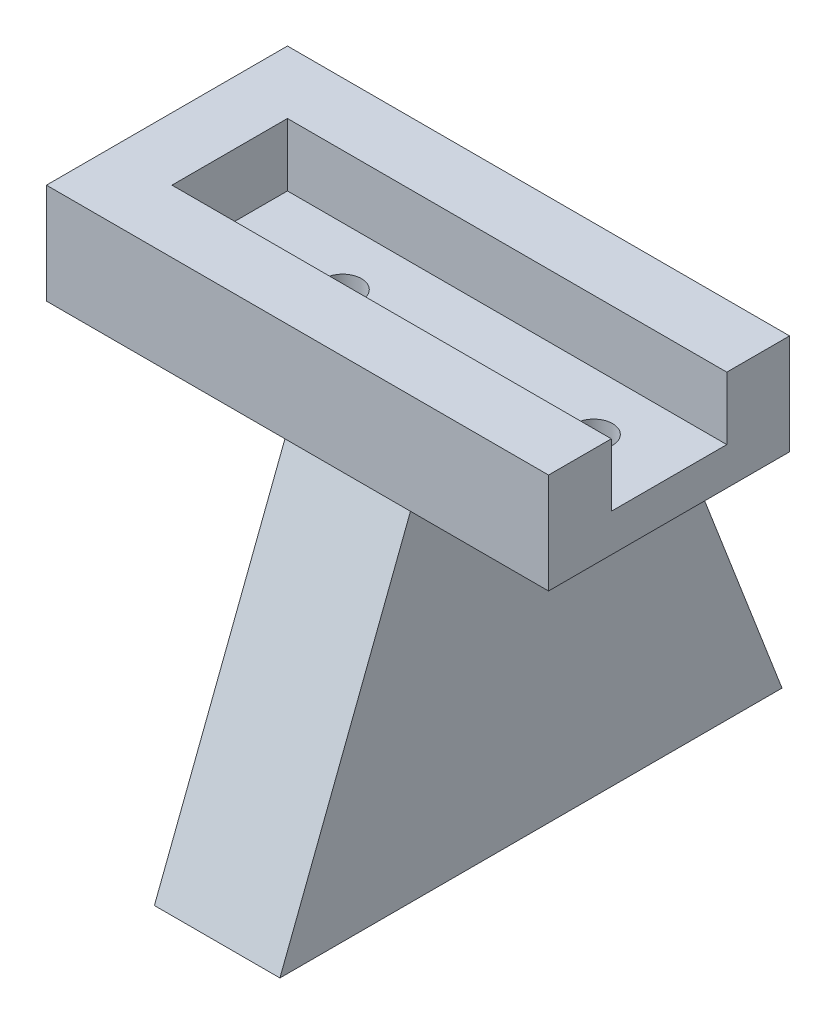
SolidWorks part; units mm, degrees
ref_plane "Front Plane" through (0, 0, 0) normal (0, 0, 1) x (1, 0, 0)
ref_plane "Top Plane" through (0, 0, 0) normal (0, 1, 0) x (1, 0, 0)
ref_plane "Right Plane" through (0, 0, 0) normal (1, 0, 0) x (0, 0, -1)
sketch "Sketch1" plane through (0, 0, 0) normal (0, 1, 0) x (1, 0, 0)
  line L1 (26, 4.5) -> (26, -4.5)
  line L2 (-8.5, 4.5) -> (-8.5, -4.5)
  line L3 (-8.5, 4.5) -> (26, 4.5)
  line L5 (26, -4.5) -> (-8.5, -4.5)
  line L7 (10, 4.5) -> (10, -4.5)
  circle A0 centre (0, 0) radius 1.5
  circle A1 centre (20, 0) radius 1.5
sketch "Sketch3" plane through (0, 0, 0) normal (1, 0, 0) x (0, 0, -1)
  line L0 (-4.6, 0) -> (-4.6, 5)
  line L3 (-4.6, 0) -> (4.6, 0)
  line L4 (-4.6, 5) -> (-9.6, 5)
  line L5 (4.6, 0) -> (4.6, 5)
  line L6 (4.6, 5) -> (9.6, 5)
  line L7 (-9.6, -3) -> (9.6, -3)
  line L8 (-9.6, 5) -> (-9.6, -3)
  line L10 (9.6, -3) -> (9.6, 5)
extrude "Boss-Extrude1" add sketch "Sketch3" along normal blind 26 and the other way blind 9
sketch "Sketch4" plane through (0, 0, 0) normal (0, 1, 0) x (1, 0, 0)
  circle A0 centre (0, 0) radius 1.5
  circle A1 centre (20, 0) radius 1.5
extrude "Cut-Extrude1" cut sketch "Sketch4" against normal through all both and the other way through all
ref_plane "Plane1" through (10, 0, 0) normal (1, 0, 0) x (0, 0, -1)
sketch "Sketch6" plane through (10, 0, 0) normal (1, 0, 0) x (0, 0, -1)
  line L0 (-20, -30) -> (-9.6, -3)
  line L1 (-9.6, -3) -> (9.6, -3)
  line L2 (-20, -30) -> (20, -30)
  line L3 (20, -30) -> (9.6, -3)
extrude "Boss-Extrude2" add sketch "Sketch6" along normal mid plane 10
sketch "Sketch7" plane through (-9, 0, 0) normal (-1, 0, 0) x (0, 0, 1)
  line L0 (-9.6, 5) -> (9.6, 5)
  line L1 (9.6, 5) -> (9.6, -3)
  line L2 (9.6, -3) -> (-9.6, -3)
  line L3 (-9.6, -3) -> (-9.6, 5)
extrude "Boss-Extrude3" add sketch "Sketch7" along normal blind 5
